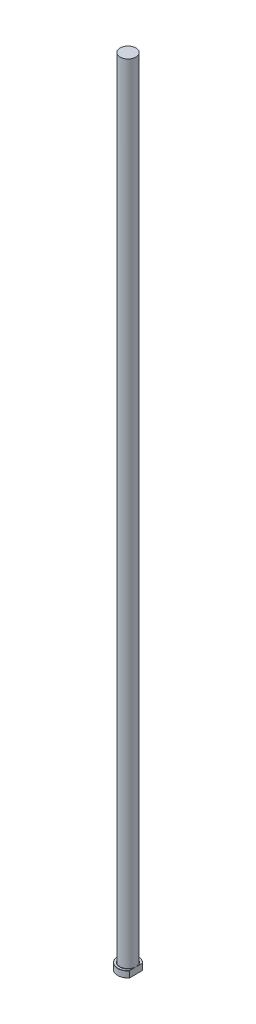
SolidWorks part; units mm, degrees
ref_plane "Front Plane" through (0, 0, 0) normal (0, 0, 1) x (1, 0, 0)
ref_plane "Top Plane" through (0, 0, 0) normal (0, 1, 0) x (1, 0, 0)
ref_plane "Right Plane" through (0, 0, 0) normal (1, 0, 0) x (0, 0, -1)
sketch "Sketch1" plane through (0, 0, 0) normal (0, 0, 1) x (1, 0, 0)
  line L0 (0, 259.9588) -> (0, -15.1925) construction
  line L1 (0, 0) -> (-13, 0)
  line L2 (-13, 0) -> (-13, 8)
  line L3 (-13, 8) -> (-10, 8)
  line L4 (-10, 8) -> (-10, 1000)
  line L5 (-10, 1000) -> (0, 1000)
  line L6 (0, 1000) -> (0, 0)
  dimension "L" = 1000
  dimension "H" = 26
  dimension "T" = 8
  dimension "D" = 20
revolve "Revolve1" add sketch "Sketch1" angle 360 about L0
chamfer "Chamfer1" distance 0.2 angle 45 2 edges at (0, 8, 13) (0, 0, 13)
fillet "Fillet1" radius 0.3 1 edges at (0, 8, 10)
sketch "Sketch2" plane through (0, 0, 0) normal (0, 1, 0) x (1, 0, 0)
  line L0 (10, 8.3066) -> (10, -8.3066)
  circle A0 centre (0, 0) radius 13 construction
  arc A1 (10, -8.3066) -> (10, 8.3066) centre (0, 0) ccw
  circle A2 centre (0, 0) radius 10 construction
extrude "KEY" cut sketch "Sketch2" along normal through all
